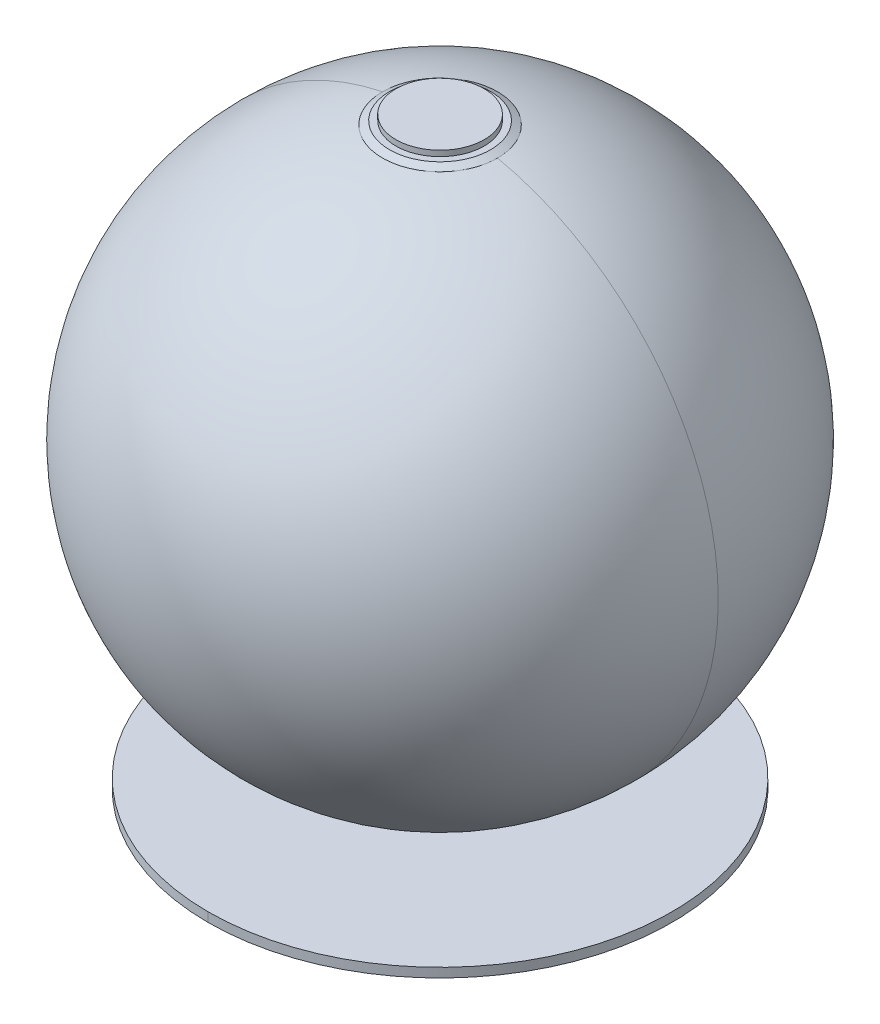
SolidWorks part; units mm, degrees
ref_plane "Alzado" through (0, 0, 0) normal (0, 0, 1) x (1, 0, 0)
ref_plane "Planta" through (0, 0, 0) normal (0, 1, 0) x (1, 0, 0)
ref_plane "Vista lateral" through (0, 0, 0) normal (1, 0, 0) x (0, 0, -1)
imported_body "TOULON_S1365.STEP-1/colgante1.STEP-1/tubo ison 300.STEP-1-solid1"
imported_body "TOULON_S1365.STEP-1/colgante1.STEP-1/bola ulon.STEP-1-solid1"
imported_body "TOULON_S1365.STEP-1/base sobremesa.STEP-1-solid1"
sketch "Croquis1" plane through (0, 287.0385, 0) normal (0, 1, 0) x (1, 0, 0)
  circle A0 centre (-5.4956, 0) radius 31
extrude "Cortar-Extruir1" cut sketch "Croquis1" against normal blind 10
sketch "Croquis3" plane through (0, 277.0385, 0) normal (0, 1, 0) x (1, 0, 0)
  circle A0 centre (-5.4956, 0) radius 31
extrude "Saliente-Extruir1" add sketch "Croquis3" along normal blind 2 draft 62 separate body
sketch "Croquis4" plane through (0, 279.0385, 0) normal (0, 1, 0) x (1, 0, 0)
  circle A0 centre (-5.4956, 0) radius 23.7947
extrude "Saliente-Extruir2" add sketch "Croquis4" along normal blind 3
